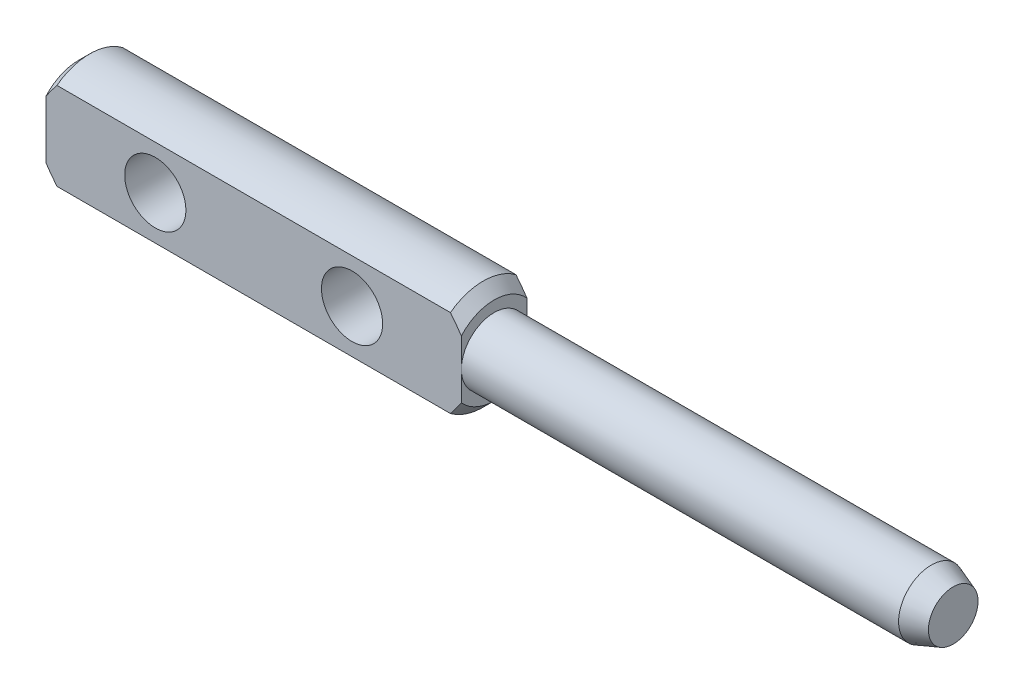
SolidWorks part; units mm, degrees
ref_plane "Front Plane" through (0, 0, 0) normal (0, 0, 1) x (1, 0, 0)
ref_plane "Top Plane" through (0, 0, 0) normal (0, 1, 0) x (1, 0, 0)
ref_plane "Right Plane" through (0, 0, 0) normal (1, 0, 0) x (0, 0, -1)
sketch "Sketch1" plane through (0, 0, 0) normal (0, 0, 1) x (1, 0, 0)
  line L0 (0, 0) -> (40, 0) construction
  line L1 (0, 0) -> (0, 2)
  line L2 (0.5, 2.5) -> (18.5, 2.5)
  line L3 (19, 2) -> (19, 1.5)
  line L4 (19, 1.5) -> (39, 1.5)
  line L5 (39, 1.5) -> (40, 1.136)
  line L6 (40, 1.136) -> (40, 0)
  line L7 (0, 2) -> (0.5, 2.5)
  line L8 (18.5, 2.5) -> (19, 2)
  line L9 (0, 0) -> (40, 0)
  point P4 (0, 2.5)
  point P5 (19, 2.5)
  dimension "D1" = 5
  dimension "D2" = 3
  dimension "D3" = 1
  dimension "L1" = 19
  dimension "L2" = 21
  dimension "D4" = 20
revolve "Revolve1" add sketch "Sketch1" angle 360 about L0
sketch "Sketch2" plane through (0, 0, 0) normal (-1, 0, 0) x (0, 0, 1)
  line L1 (-1.5, -2.5) -> (1.5, -2.5)
  line L2 (-1.5, -2.5) -> (-1.5, 2.5)
  line L3 (-1.5, 2.5) -> (1.5, 2.5)
  line L4 (1.5, -2.5) -> (1.5, 2.5)
  line L5 (-1.5, -2.5) -> (1.5, 2.5) construction
  line L6 (-1.5, 2.5) -> (1.5, -2.5) construction
  circle A0 centre (0, 0) radius 2.5 construction
  point P0 (0, 0)
  dimension "E" = 3
extrude "Cut-Extrude1" cut sketch "Sketch2" against normal blind 19 flip side to cut
sketch "Sketch4" plane through (0, 0, 1.5) normal (0, 0, 1) x (1, 0, 0)
  circle A0 centre (5, 0) radius 1.4
  circle A1 centre (14, 0) radius 1.4
  dimension "D1" = 9
  dimension "F1" = 2.8
  dimension "D2" = 2.8
  dimension "H1" = 5
extrude "Cut-Extrude2" cut sketch "Sketch4" against normal through all
